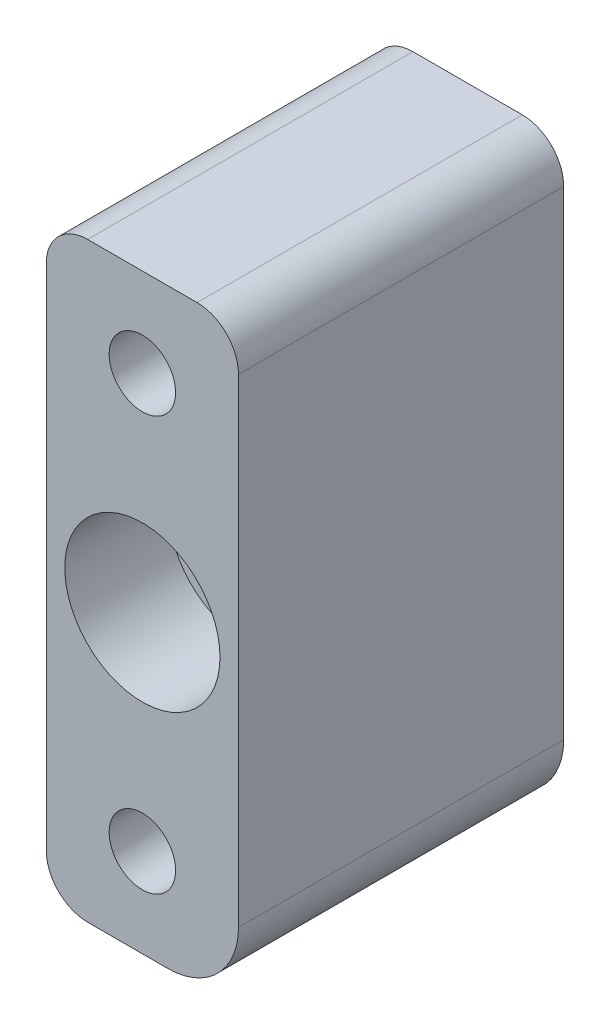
SolidWorks part; units mm, degrees
ref_plane "Front" through (0, 0, 0) normal (0, 0, 1) x (1, 0, 0)
ref_plane "Top" through (0, 0, 0) normal (0, 1, 0) x (1, 0, 0)
ref_plane "Right" through (0, 0, 0) normal (1, 0, 0) x (0, 0, -1)
ref_plane "Plane1"
sketch "Sketch1" plane through (0, 0, 40.2082) normal (0, 0, -1) x (-1, 0, 0)
  line L0 (920.0828, -30.9504) -> (920.0828, -14.2719) construction
  line L1 (920.0828, -30.9504) -> (941.4293, -30.9504) construction
  line L2 (914.209, 0.7996) -> (925.9565, 0.7996)
  line L3 (909.764, -3.6454) -> (909.764, -55.0804)
  line L4 (917.384, -62.7004) -> (925.9565, -62.7004)
  line L5 (930.4015, -3.6454) -> (930.4015, -58.2554)
  line L6 (903.7633, -48.7304) -> (903.7633, -13.1704) construction
  circle A0 centre (920.0828, -30.9504) radius 4.0229 construction
  circle A1 centre (920.0828, -30.9504) radius 4.0229 construction
  arc A2 (909.764, -55.0804) -> (917.384, -62.7004) centre (917.384, -55.0804) ccw
  arc A3 (925.9565, -62.7004) -> (930.4015, -58.2554) centre (925.9565, -58.2554) ccw
  arc A4 (925.9565, 0.7996) -> (930.4015, -3.6454) centre (925.9565, -3.6454) cw
  arc A5 (914.209, 0.7996) -> (909.764, -3.6454) centre (914.209, -3.6454) ccw
extrude "Boss-Extrude1" add sketch "Sketch1" against normal blind 31.75 flip side to cut
hole_wizard "Hole1" positions "Point_Sketch" profile "Profil_Sketch" counterbore size "1/4" standard "ANSI Inch"
sketch "Point_Sketch" plane through (-932.9519, -30.0154, 71.9582) normal (0, 0, -1) x (1, 0, 0)
  point P0 (12.8691, 0.935)
sketch "Profil_Sketch" plane through (-920.0828, -30.9504, 71.9582) normal (1, 0, 0) x (0, -1, 0)
  line L0 (0, 0) -> (0, 31.75)
  line L1 (0, 31.75) -> (6.35, 31.75)
  line L3 (6.35, 31.75) -> (6.35, 11.1252)
  line L4 (6.35, 11.1252) -> (8.3344, 11.1252)
  line L5 (8.3344, 11.1252) -> (8.3344, 0)
  line L7 (8.3344, 0) -> (0, 0)
  line L11 (0, -6.35) -> (0, 107.95) construction
  dimension "Diameter" = 12.7
  dimension "Thru Hole Depth" = 31.75
  dimension "L1" = 11.1252
other "usin_LS160_IMPAX VARIABLE INCH ISPV 050-300 4 RD P=0.4000<1>"
hole_wizard "Hole11" positions "Point_Sketch1" profile "Profil_Sketch1" counterbore size "1/4" standard "ANSI Inch"
sketch "Point_Sketch1" plane through (-907.2137, -7.7904, 40.2082) normal (0, 0, 1) x (-1, 0, 0)
  point P0 (12.8691, 0.935)
  point P2 (12.8691, 45.385)
sketch "Profil_Sketch1" plane through (-920.0828, -8.7254, 40.2082) normal (1, 0, 0) x (0, 1, 0)
  line L0 (0, 0) -> (0, 31.75)
  line L1 (0, 31.75) -> (3.5687, 31.75)
  line L3 (3.5687, 31.75) -> (3.5687, 9.652)
  line L4 (3.5687, 9.652) -> (5.3594, 9.652)
  line L5 (5.3594, 9.652) -> (5.3594, 0)
  line L7 (5.3594, 0) -> (0, 0)
  line L11 (0, -6.35) -> (0, 107.95) construction
  dimension "Diameter" = 7.1374
  dimension "Thru Hole Depth" = 31.75
  dimension "L1" = 9.652
other "usin_LS160_.25-20x1.75-SHCS<2>"
other "Move Face1" parameters "D1"=3.175
